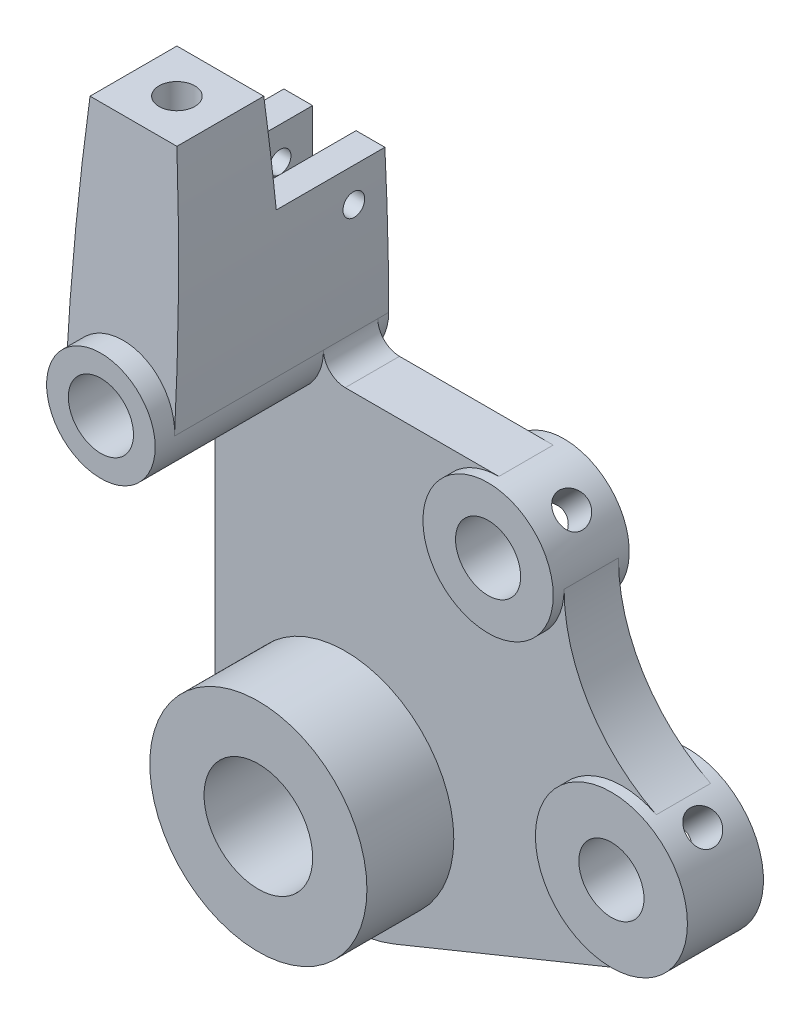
SolidWorks part; units mm, degrees
ref_plane "前视基准面" through (0, 0, 0) normal (0, 0, 1) x (1, 0, 0)
ref_plane "上视基准面" through (0, 0, 0) normal (0, 1, 0) x (1, 0, 0)
ref_plane "右视基准面" through (0, 0, 0) normal (1, 0, 0) x (0, 0, -1)
sketch "草图1" plane through (0, 0, 0) normal (0, 0, 1) x (1, 0, 0)
  line L0 (-12, 0) -> (-12, 33)
  line L1 (-11, 55) -> (-3, 55)
  line L3 (-7, 33) -> (-7, 23.3051) construction
  line L4 (14.1569, 31) -> (0, 31)
  line L5 (4.5292, -11.1124) -> (28.1568, -1.4822)
  arc A0 (-12, 0) -> (4.5292, -11.1124) centre (0, 0) ccw
  arc A1 (-12, 33) -> (-11, 55) centre (230.5, 33) cw
  circle A2 centre (-7, 33) radius 5 construction
  arc A3 (-2, 33) -> (-3, 55) centre (-244.5, 33) ccw
  circle A4 centre (0, 0) radius 14 construction
  circle A5 centre (25.5147, 5) radius 12 construction
  arc A6 (28.1568, -1.4822) -> (28.6465, 11.2603) centre (25.5147, 5) ccw
  circle A7 centre (14.1569, 25) radius 11 construction
  arc A8 (20.1569, 25) -> (14.1569, 31) centre (14.1569, 25) ccw
  arc A9 (0, 31) -> (-2, 33) centre (0, 33) cw
  arc A10 (20.1569, 25) -> (28.6465, 11.2603) centre (35.5199, 25) ccw
  dimension "D1" = 24
  dimension "D4" = 10
  dimension "D6" = 28
  dimension "D7" = 24
  dimension "D9" = 14
  dimension "D10" = 22
  dimension "D12" = 12
  dimension "D2" = 33
  dimension "D3" = 55
  dimension "D5" = 8
  dimension "D8" = 5
  dimension "D11" = 20
extrude "拉伸1" add sketch "草图1" along normal blind 5
sketch "草图2" plane through (0, 0, 5) normal (0, 0, 1) x (1, 0, 0)
  circle A0 centre (14.1569, 25) radius 6
  circle A1 centre (25.5147, 5) radius 7
  arc A2 (20.1569, 25) -> (14.1569, 31) centre (14.1569, 25) ccw construction
  arc A3 (28.1568, -1.4822) -> (28.6465, 11.2603) centre (25.5147, 5) ccw construction
extrude "拉伸2" add sketch "草图2" along normal blind 1
sketch "草图3" plane through (0, 0, 5) normal (0, 0, 1) x (1, 0, 0)
  circle A0 centre (0, 0) radius 10
  dimension "D1" = 20
extrude "拉伸3" add sketch "草图3" along normal blind 8
sketch "草图4" plane through (0, 0, 5) normal (0, 0, 1) x (1, 0, 0)
  line L0 (-11, 55) -> (-3, 55) construction
  line L1 (-11, 55) -> (-3, 55)
  circle A0 centre (-7, 33) radius 5 construction
  arc A1 (-11, 55) -> (-12, 33) centre (230.5, 33) ccw construction
  arc A2 (-2, 33) -> (-3, 55) centre (-244.5, 33) ccw construction
  arc A3 (-12, 33) -> (-2, 33) centre (-7, 33) ccw
  arc A4 (-11, 55) -> (-12, 33) centre (230.5, 33) ccw
  arc A5 (-2, 33) -> (-3, 55) centre (-244.5, 33) ccw
extrude "拉伸4" add sketch "草图4" along normal blind 14
ref_plane "基准面1" through (-7, 0, 0) normal (1, 0, 0) x (0, 0, -1)
sketch "草图6" plane through (-7, 0, 0) normal (1, 0, 0) x (0, 0, -1)
  line L0 (0, 46) -> (-9, 46)
  line L1 (0, 33) -> (0, 55) construction
  line L2 (-9, 46) -> (-9.5, 55)
  line L3 (-19, 55) -> (0, 55) construction
  line L4 (0, 46) -> (0, 55)
  line L5 (-17.5, 55) -> (-19, 28)
  line L6 (-19, 28) -> (-19, 55)
  line L7 (-19, 55) -> (-17.5, 55)
  line L8 (0, 55) -> (-9.5, 55)
  line L9 (-13.5, 62.306) -> (-13.5, 41.5985) construction
  dimension "D1" = 4
  dimension "D2" = 9
extrude "切除-拉伸1" cut sketch "草图6" against normal mid plane 10
ref_plane "基准面2" through (0, 0, 17.5) normal (0, 0, 1) x (1, 0, 0)
ref_plane "基准面3" through (0, 0, 20.5) normal (0, 0, 1) x (1, 0, 0)
sketch "草图7" plane through (0, 0, 20.5) normal (0, 0, 1) x (1, 0, 0)
  circle A0 centre (-7, 33) radius 5
  arc A1 (-12, 33) -> (-2, 33) centre (-7, 33) ccw construction
extrude "拉伸6" add sketch "草图7" against normal up to surface (1.7778 mm away)
sketch "草图12" plane through (0, 0, 0) normal (0, 0, -1) x (-1, 0, 0)
  line L0 (11.6513, 46) -> (2.3487, 46) construction
  line L1 (11.6513, 46) -> (2.3487, 46)
  arc A0 (12, 33) -> (11.6513, 46) centre (-230.5, 33) ccw construction
  arc A1 (2, 33) -> (12, 33) centre (7, 33) ccw construction
  arc A2 (2.3487, 46) -> (2, 33) centre (244.5, 33) ccw construction
  arc A3 (12, 33) -> (11.6513, 46) centre (-230.5, 33) ccw
  arc A4 (2, 33) -> (12, 33) centre (7, 33) ccw
  arc A5 (2.3487, 46) -> (2, 33) centre (244.5, 33) ccw
  arc A6 (-14.1569, 31) -> (-20.1569, 25) centre (-14.1569, 25) ccw construction
  arc A7 (-20.1569, 25) -> (-14.1569, 31) centre (-14.1569, 25) ccw construction
  arc A8 (-14.1569, 31) -> (-20.1569, 25) centre (-14.1569, 25) ccw
  arc A9 (-20.1569, 25) -> (-14.1569, 31) centre (-14.1569, 25) ccw
  arc A10 (-28.1568, -1.4822) -> (-28.6465, 11.2603) centre (-25.5147, 5) ccw construction
  arc A11 (-28.6465, 11.2603) -> (-28.1568, -1.4822) centre (-25.5147, 5) ccw construction
  circle A12 centre (0, 0) radius 10 construction
  arc A13 (-28.6465, 11.2603) -> (-28.1568, -1.4822) centre (-25.5147, 5) ccw
  arc A14 (-28.1568, -1.4822) -> (-28.6465, 11.2603) centre (-25.5147, 5) ccw
  circle A15 centre (0, 0) radius 10
extrude "拉伸7" add sketch "草图12" along normal blind 1
sketch "草图10" plane through (-7, 0, 0) normal (1, 0, 0) x (0, 0, -1)
  line L0 (1, 46) -> (-9, 46) construction
  line L1 (1, 46) -> (-9, 46)
  line L2 (1, 28) -> (1, 33) construction
  line L3 (1, 30.5) -> (-9, 30.5)
  line L4 (-9, 46) -> (-9, 30.5)
  line L5 (-9, 46) -> (-9.5, 55) construction
  line L7 (1, 46) -> (1, 30.5)
extrude "切除-拉伸4" cut sketch "草图10" against normal mid plane 4
sketch "草图9" plane through (0, 0, 20.5) normal (0, 0, 1) x (1, 0, 0)
  circle A0 centre (-7, 33) radius 2
  circle A1 centre (0, 0) radius 5
  circle A2 centre (14.1569, 25) radius 3
  circle A3 centre (25.5147, 5) radius 3
  dimension "D1" = 4
  dimension "D2" = 6
  dimension "D3" = 6
  dimension "D4" = 10
extrude "切除-拉伸3" cut sketch "草图9" against normal through all
sketch "草图13" plane through (-7, 0, 0) normal (1, 0, 0) x (0, 0, -1)
  line L0 (-9, 46) -> (1, 46) construction
  line L1 (1, 33) -> (1, 46) construction
  circle A0 centre (-2, 43) radius 1
  dimension "D1" = 2
  dimension "D2" = 3
  dimension "D3" = 3
extrude "切除-拉伸5" cut sketch "草图13" against normal mid plane 10
sketch "草图14" plane through (0, 0, 20.5) normal (0, 0, 1) x (1, 0, 0)
  circle A0 centre (-7, 33) radius 3
  dimension "D1" = 6
extrude "切除-拉伸6" cut sketch "草图14" against normal blind 10
sketch "草图15" plane through (0, 0, 5) normal (0, 0, 1) x (1, 0, 0)
  line L0 (18.3995, 29.2426) -> (14.1569, 25) construction
  line L1 (14.1569, 25) -> (56.4971, 25) construction
  line L2 (30.4644, 9.9497) -> (25.5147, 5) construction
  line L3 (25.5147, 5) -> (38.8478, 5) construction
  circle A0 centre (14.1569, 25) radius 6 construction
  circle A1 centre (25.5147, 5) radius 7 construction
  point P0 (18.3995, 29.2426)
  point P1 (30.4644, 9.9497)
  dimension "D1" = 45
  dimension "D2" = 45
ref_plane "基准面4" through (18.3995, 29.2426, 5) normal (0.7071, 0.7071, 0) x (0, 0, -1)
sketch "草图16" plane through (18.3995, 29.2426, 5) normal (0.7071, 0.7071, 0) x (0, 0, -1)
  line L3 (6, 0) -> (-2.8895, 0) construction
  line L4 (6, -6) -> (6, 6) construction
  line L5 (2.5, -19.9611) -> (2.5, 5.8125) construction
  line L6 (0, -19.9611) -> (5, -19.9611) construction
  circle A0 centre (2.5, 0) radius 1.5
  dimension "D1" = 3
extrude "切除-拉伸7" cut sketch "草图16" against normal up to next
ref_plane "基准面5" through (30.4644, 9.9497, 5) normal (0.7071, 0.7071, 0) x (0, 0, -1)
sketch "草图17" plane through (30.4644, 9.9497, 5) normal (0.7071, 0.7071, 0) x (0, 0, -1)
  line L0 (2.5, 2.2122) -> (2.5, -9.2951) construction
  line L1 (0, 2.2122) -> (5, 2.2122) construction
  line L2 (6, 0) -> (-4.8901, 0) construction
  line L3 (6, -7) -> (6, 7) construction
  circle A0 centre (2.5, 0) radius 1.5
  dimension "D1" = 3
extrude "切除-拉伸8" cut sketch "草图17" against normal up to next
hole_wizard "M4 螺纹孔1" positions "草图19" profile "草图18" tap size "M4" standard "ISO"
sketch "草图19" plane through (0, 55, 0) normal (0, 1, 0) x (-1, 0, 0)
  line L1 (7, 13.5) -> (3, 13.5) construction
  line L2 (3, 17.5) -> (3, 9.5) construction
  line L5 (7, 13.5) -> (7, 9.5) construction
  line L6 (11, 9.5) -> (3, 9.5) construction
  point P1 (7, 13.5)
sketch "草图18" plane through (-7, 55, 13.5) normal (1, 0, 0) x (0, 0, 1)
  line L0 (0, 0) -> (0, 8.9914)
  line L1 (0, 8.9914) -> (1.65, 8)
  line L2 (1.65, 8) -> (1.65, 0)
  line L5 (1.65, 0) -> (0, 0)
  line L10 (0, 8.9914) -> (-1.65, 8) construction
  line L11 (0, -6.35) -> (0, 107.95) construction
  dimension "蹟恇謂郰芛眻噤" = 3.3
  dimension "蹟恇謂郰芛旮僅" = 8
  dimension "絳芛褒僅" = 118
